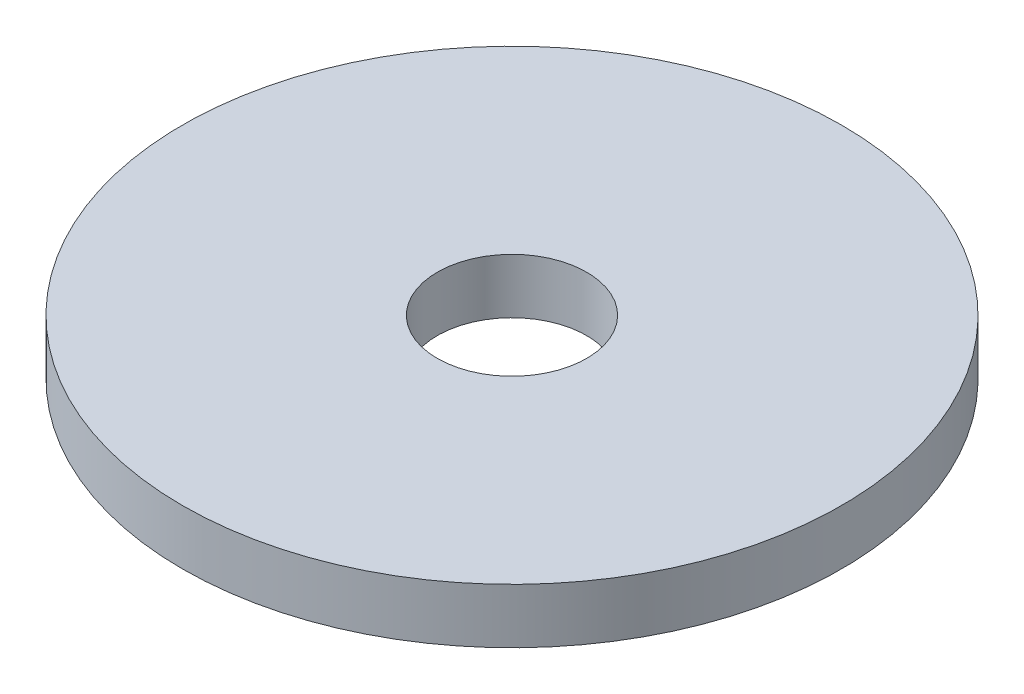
SolidWorks part; units mm, degrees
ref_plane "Plan de face" through (0, 0, 0) normal (0, 0, 1) x (1, 0, 0)
ref_plane "Plan de dessus" through (0, 0, 0) normal (0, 1, 0) x (1, 0, 0)
ref_plane "Plan de droite" through (0, 0, 0) normal (1, 0, 0) x (0, 0, -1)
sketch "Esquisse1" plane through (0, 0, 0) normal (0, 1, 0) x (1, 0, 0)
  circle A0 centre (0, 0) radius 15
  circle A1 centre (0, 0) radius 3.4
  dimension "D1" = 6.8
  dimension "D2" = 30
extrude "Extrusion1" add sketch "Esquisse1" along normal blind 2.5
